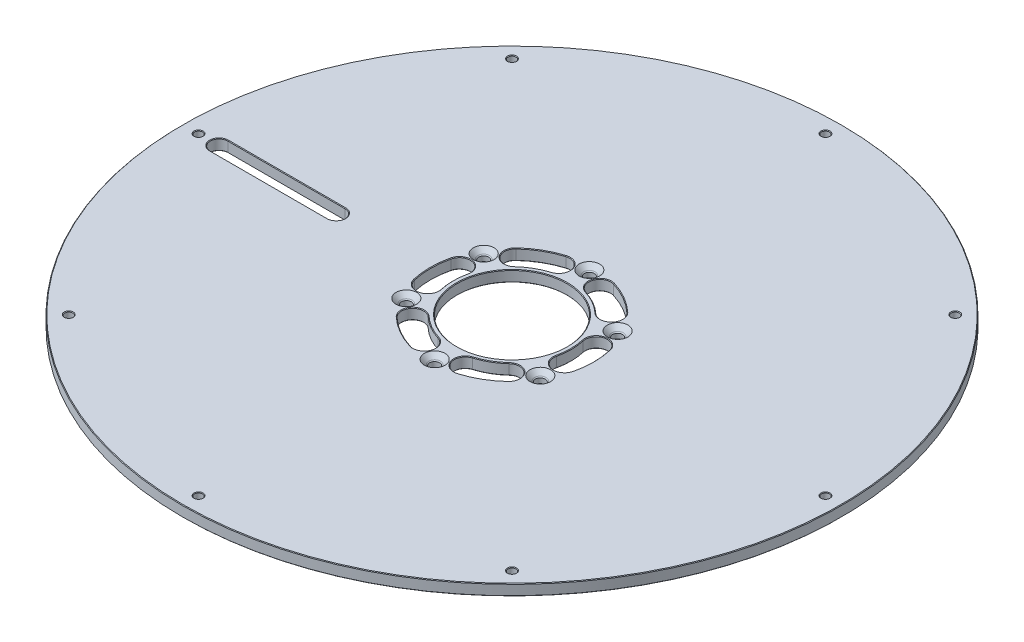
SolidWorks part; units mm, degrees
ref_plane "Front Plane" through (0, 0, 0) normal (0, 0, 1) x (1, 0, 0)
ref_plane "Top Plane" through (0, 0, 0) normal (0, 1, 0) x (1, 0, 0)
ref_plane "Right Plane" through (0, 0, 0) normal (1, 0, 0) x (0, 0, -1)
sketch "Sketch1" plane through (0, 0, 0) normal (0, 0, 1) x (1, 0, 0)
  line L0 (0, 0) -> (0, 40.0271) construction
  line L1 (-23.8125, 0) -> (-142.875, 0)
  line L2 (-142.875, 0) -> (-142.875, -4.7625)
  line L3 (-23.8125, -4.7625) -> (-142.875, -4.7625)
  line L4 (-23.8125, 0) -> (-23.8125, -4.7625)
  dimension "D1" = 285.75
  dimension "D2" = 4.7625
  dimension "D3" = 47.625
revolve "Revolve1" add sketch "Sketch1" angle 360 about L0
sketch "Sketch5" plane through (0, 0, 0) normal (0, 1, 0) x (1, 0, 0)
  line L0 (-76.2, -3.81) -> (-127, -3.81)
  line L1 (-76.2, 3.81) -> (-127, 3.81)
  line L2 (-127, 0) -> (-76.2, 0) construction
  arc A0 (-76.2, -3.81) -> (-76.2, 3.81) centre (-76.2, 0) ccw
  arc A1 (-127, 3.81) -> (-127, -3.81) centre (-127, 0) ccw
  circle A2 centre (0, 0) radius 23.8125 construction
  dimension "D1" = 3.81
  dimension "D2" = 76.2
  dimension "D3" = 127
  dimension "D4" = 3.81
extrude "Cut-Extrude1" cut sketch "Sketch5" against normal through all
hole_wizard "#8-32 Tapped Hole1" positions "Sketch8" profile "Sketch7" tap size "#8-32" standard "ANSI Inch"
sketch "Sketch8" plane through (0, 0, 0) normal (0, 1, 0) x (1, 0, 0)
  line L0 (0, -135.89) -> (0, 0) construction
  point P0 (0, -135.89)
  dimension "D1" = 135.89
sketch "Sketch7" plane through (0, 0, 135.89) normal (1, 0, 0) x (0, 0, 1)
  line L0 (0, 0) -> (0, 12.446)
  line L1 (0, 12.446) -> (1.7272, 12.446)
  line L2 (1.7272, 12.446) -> (1.7272, 0)
  line L5 (1.7272, 0) -> (0, 0)
  line L10 (0, 12.446) -> (-1.7272, 12.446) construction
  line L11 (0, -6.35) -> (0, 107.95) construction
  dimension "Tap Drill Dia." = 3.4544
  dimension "Tap Drill Depth" = 12.446
  dimension "Drill Angle" = 180
pattern_circular "CirPattern1" count 8 over 360 about axis through (0, 0, 0) along (0, 1, 0) of "#8-32 Tapped Hole1"
hole_wizard "CSK for #8 Flat Head Machine Screw1" positions "Sketch10" profile "Sketch9" countersink size "#8" standard "ANSI Inch"
sketch "Sketch10" plane through (0, 0, 0) normal (0, 1, 0) x (1, 0, 0)
  line L0 (0, 28.575) -> (0, 0) construction
  line L1 (0, 0) -> (-29.0361, 16.764) construction
  point P4 (-29.0361, 16.764)
  dimension "D2" = 60
  dimension "D3" = 33.528
sketch "Sketch9" plane through (-29.0361, 0, -16.764) normal (1, 0, 0) x (0, 0, 1)
  line L0 (0, 0) -> (0, 4.7625)
  line L1 (0, 4.7625) -> (2.1526, 4.7625)
  line L2 (2.1526, 4.7625) -> (2.1526, 2.3741)
  line L3 (2.1526, 2.3741) -> (4.2164, 0)
  line L5 (4.2164, 0) -> (0, 0)
  line L6 (-2.1526, 2.3741) -> (-4.2164, 0) construction
  line L11 (0, -6.35) -> (0, 107.95) construction
  dimension "Thru Hole Dia." = 4.3053
  dimension "Thru Hole Depth" = 4.7625
  dimension "Near C'Sink Dia." = 8.4328
  dimension "Near C'Sink Angle" = 82
pattern_circular "CirPattern2" count 6 over 360 about axis through (0, 0, 0) along (0, 1, 0) of "CSK for #8 Flat Head Machine Screw1"
sketch "Sketch11" plane through (0, 0, 0) normal (0, 1, 0) x (1, 0, 0)
  line L0 (0, 0) -> (-20.7873, -22.2917) construction
  line L1 (-13.6339, 0) -> (0, 0) construction
  line L2 (0, 0) -> (-8.9115, -29.1482) construction
  line L3 (0, 0) -> (-29.0361, -16.764) construction
  line L4 (-26.3965, -15.24) -> (0, -30.48) construction
  line L5 (-12.8524, -22.261) -> (0, 0) construction
  line L6 (-29.0361, -16.764) -> (-26.3965, -15.24) construction
  line L7 (0, -30.48) -> (0, 0) construction
  line L8 (-13.1982, -22.86) -> (-12.8524, -22.261) construction
  arc A0 (-10.3076, -33.7147) -> (-7.5154, -24.5816) centre (-8.9115, -29.1482) ccw
  circle A1 centre (0, 0) radius 30.48 construction
  arc A2 (-17.5306, -18.7993) -> (-7.5154, -24.5816) centre (0, 0) ccw
  arc A3 (-24.044, -25.784) -> (-10.3076, -33.7147) centre (0, 0) ccw
  arc A4 (-17.5306, -18.7993) -> (-24.044, -25.784) centre (-20.7873, -22.2917) ccw
  dimension "D3" = 60.96
  dimension "D4" = 4.7752
  dimension "D1" = 26
extrude "Cut-Extrude2" cut sketch "Sketch11" against normal through all
pattern_circular "CirPattern3" count 6 over 360 about axis through (0, 0, 0) along (0, 1, 0) of "Cut-Extrude2"
chamfer "Chamfer1" distance 0.254 angle 45 88 edges at (-101.6, 0, -3.81) (-130.81, 0, 0) (-72.39, 0, 0) (-101.6, 0, 3.81) (0, -4.7625, -142.875) (0, -4.7625, -23.8125) (-72.39, -4.7625, 0) (-101.6, -4.7625, 3.81) (-130.81, -4.7625, 0) (-101.6, -4.7625, -3.81) (0, -4.7625, 137.6172) (-96.0887, -4.7625, 97.8159) (-135.89, -4.7625, 1.7272) (-96.0887, -4.7625, -94.3615) (0, -4.7625, -134.1628) (96.0887, -4.7625, -94.3615) (135.89, -4.7625, 1.7272) (96.0887, -4.7625, 97.8159) (-17.6276, -4.7625, 30.5319) (-24.2797, -4.7625, 19.035) (-12.8524, -4.7625, 22.261) (-4.3449, -4.7625, 30.5443) (-35.2552, -4.7625, 0) (-28.6246, -4.7625, -11.5093) (-25.7048, -4.7625, 0) (-28.6246, -4.7625, 11.5093) (-17.6276, -4.7625, -30.5319) (-4.3449, -4.7625, -30.5443) (-12.8524, -4.7625, -22.261) (-24.2797, -4.7625, -19.035) (17.6276, -4.7625, -30.5319) (24.2797, -4.7625, -19.035) (12.8524, -4.7625, -22.261) (4.3449, -4.7625, -30.5443) (35.2552, -4.7625, 0) (28.6246, -4.7625, 11.5093) (25.7048, -4.7625, 0) (28.6246, -4.7625, -11.5093) (17.6276, -4.7625, 30.5319) (4.3449, -4.7625, 30.5443) (12.8524, -4.7625, 22.261) (24.2797, -4.7625, 19.035) (96.0887, 0, 97.8159) (96.0887, 0, -94.3615) (-96.0887, 0, -94.3615) (0, 0, -23.8125) (0, 0, -142.875) (0, 0, 137.6172) (-96.0887, 0, 97.8159) (-135.89, 0, 1.7272) (0, 0, -134.1628) (135.89, 0, 1.7272) (-29.0361, 0, -12.5476) (0, 0, -29.3116) (29.0361, 0, -12.5476) (-17.6276, 0, 30.5319) (-4.3449, 0, 30.5443) (-12.8524, 0, 22.261) (-24.2797, 0, 19.035) (-35.2552, 0, 0) (-28.6246, 0, 11.5093) (-25.7048, 0, 0) (-28.6246, 0, -11.5093) (-17.6276, 0, -30.5319) (-24.2797, 0, -19.035) (-12.8524, 0, -22.261) (-4.3449, 0, -30.5443) (17.6276, 0, -30.5319) (4.3449, 0, -30.5443) (12.8524, 0, -22.261) (24.2797, 0, -19.035) (35.2552, 0, 0) (28.6246, 0, -11.5093) (25.7048, 0, 0) (28.6246, 0, 11.5093) (17.6276, 0, 30.5319) (24.2797, 0, 19.035) (12.8524, 0, 22.261) (4.3449, 0, 30.5443) (-29.0361, 0, 20.9804) (29.0361, 0, 20.9804) (0, 0, 37.7444) (-29.0361, -4.7625, -14.6114) (0, -4.7625, -31.3754) (29.0361, -4.7625, -14.6113) (29.0361, -4.7625, 18.9167) (0, -4.7625, 35.6806) (-29.0361, -4.7625, 18.9166)
